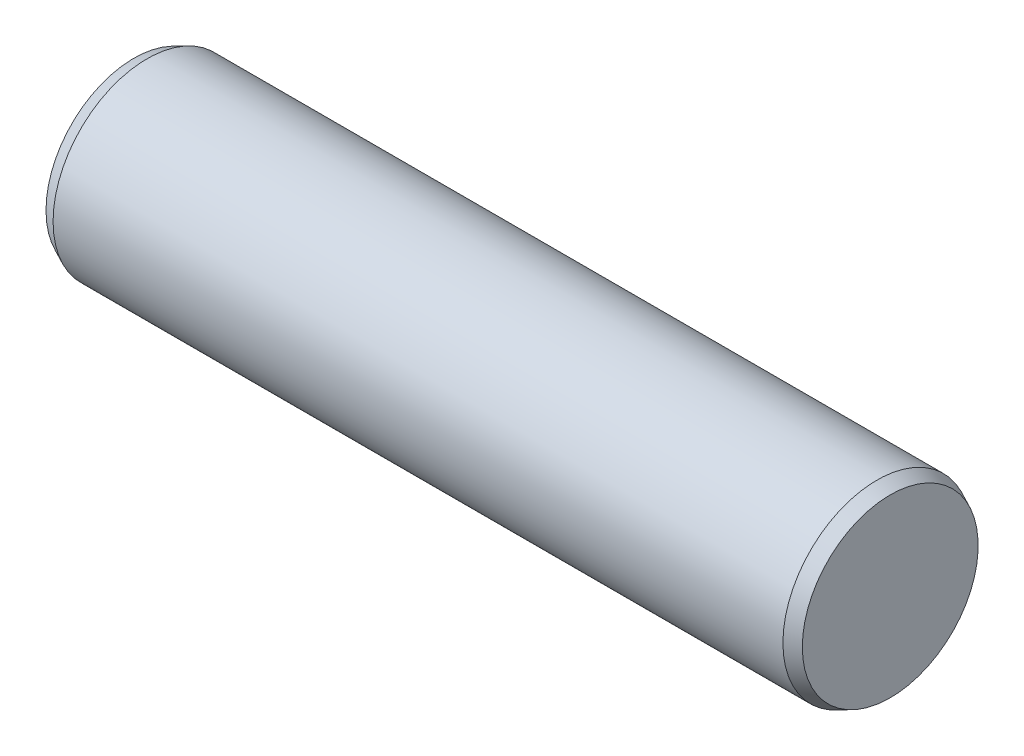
SolidWorks part; units mm, degrees
ref_plane "Plane1" through (0, 0, 0) normal (0, 0, 1) x (1, 0, 0)
ref_plane "Plane2" through (0, 0, 0) normal (0, 1, 0) x (1, 0, 0)
ref_plane "Plane3" through (0, 0, 0) normal (1, 0, 0) x (0, 0, -1)
sketch "Sketch1" plane through (0, 0, 0) normal (0, 0, 1) x (1, 0, 0)
  line L1 (-6.35, 0) -> (107.95, 0) construction
  line L2 (0, 0) -> (101.6, 0)
  line L3 (101.6, 0) -> (101.6, 11.8099)
  line L4 (101.6, 11.8099) -> (99.822, 12.639)
  line L5 (99.822, 12.639) -> (1.778, 12.639)
  line L6 (0, 11.8099) -> (0, 0)
  line L7 (1.778, 12.639) -> (0, 11.8099)
  dimension "D1" = 25
  dimension "D2" = 1.778
  dimension "D3" = 25
  dimension "Diameter" = 25.2781
  dimension "Length" = 101.6
  dimension "Chamfer_length" = 1.778
revolve "Base-Revolve" add sketch "Sketch1" angle 360 about L1
equation "\"D2@Sketch1\" = \"Chamfer_length@Sketch1\""
